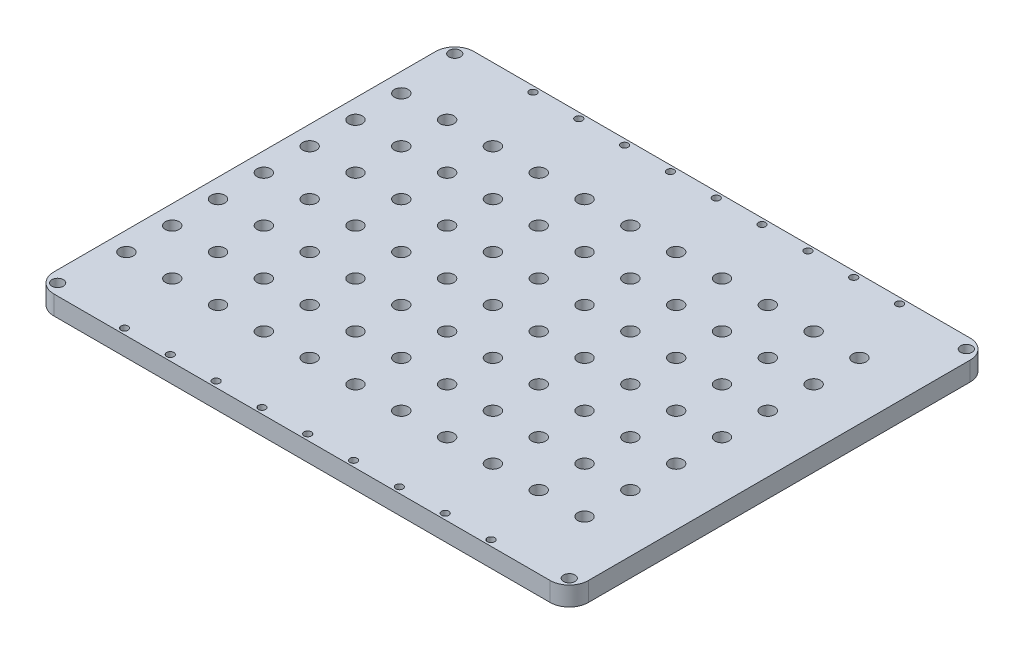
SolidWorks part; units mm, degrees
ref_plane "Front Plane" through (0, 0, 0) normal (0, 0, 1) x (1, 0, 0)
ref_plane "Top Plane" through (0, 0, 0) normal (0, 1, 0) x (1, 0, 0)
ref_plane "Right Plane" through (0, 0, 0) normal (1, 0, 0) x (0, 0, -1)
sketch "Sketch1" plane through (0, 0, 0) normal (0, 1, 0) x (1, 0, 0)
  line L1 (-70, 55) -> (70, 55)
  line L2 (-70, 55) -> (-70, -55)
  line L3 (-70, -55) -> (70, -55)
  line L4 (70, 55) -> (70, -55)
  line L5 (-70, 55) -> (70, -55) construction
  line L6 (-70, -55) -> (70, 55) construction
  point P0 (0, 0)
  dimension "D1" = 110
  dimension "D2" = 140
extrude "Boss-Extrude1" add sketch "Sketch1" along normal blind 5
fillet "Fillet1" radius 5 4 edges at (70, 2.5, -55) (70, 2.5, 55) (-70, 2.5, 55) (-70, 2.5, -55)
sketch "Sketch2" plane through (0, 5, 0) normal (0, 1, 0) x (1, 0, 0)
  line L4 (-68.5355, 53.5355) -> (-67.0011, 52.0011)
  line L8 (67, -50) -> (67, 50)
  line L9 (65, 52) -> (-65, 52)
  line L10 (-67, 50) -> (-67, -50)
  line L11 (-65, -52) -> (65, -52)
  line L12 (67, -50) -> (67, 50)
  line L13 (65, 52) -> (-65, 52)
  line L14 (-67, 50) -> (-67, -50)
  line L15 (-65, -52) -> (65, -52)
  arc A6 (-65, 55) -> (-70, 50) centre (-65, 50) ccw construction
  circle A7 centre (-67.0011, 52.0011) radius 1.5
  arc A8 (67, 50) -> (65, 52) centre (65, 50) ccw
  arc A9 (-65, 52) -> (-67, 50) centre (-65, 50) ccw
  arc A10 (-67, -50) -> (-65, -52) centre (-65, -50) ccw
  arc A11 (65, -52) -> (67, -50) centre (65, -50) ccw
  arc A12 (67, 50) -> (65, 52) centre (65, 50) ccw
  arc A13 (-65, 52) -> (-67, 50) centre (-65, 50) ccw
  arc A14 (-67, -50) -> (-65, -52) centre (-65, -50) ccw
  arc A15 (65, -52) -> (67, -50) centre (65, -50) ccw
  circle A16 centre (66.9989, 52.0011) radius 1.5
  circle A17 centre (66.9989, -51.9989) radius 1.5
  circle A18 centre (-67.0011, -51.9989) radius 1.5
  dimension "D2" = 2
  dimension "D1" = 3
  dimension "D3" = 2
extrude "Cut-Extrude1" cut sketch "Sketch2" against normal blind 5
sketch "Sketch3" plane through (0, 5, 0) normal (0, 1, 0) x (1, 0, 0)
  line L0 (0, -55) -> (0, -52)
  line L1 (-65, -55) -> (65, -55) construction
  circle A0 centre (0, -53.5) radius 0.95
  circle A1 centre (12, -53.5) radius 0.95
  circle A2 centre (24, -53.5) radius 0.95
  circle A3 centre (36, -53.5) radius 0.95
  circle A4 centre (48, -53.5) radius 0.95
  circle A5 centre (0, -53.5) radius 0.95
  circle A6 centre (12, -53.5) radius 0.95
  circle A7 centre (24, -53.5) radius 0.95
  circle A8 centre (36, -53.5) radius 0.95
  circle A9 centre (-12, -53.5) radius 0.95
  circle A10 centre (0, -53.5) radius 0.95
  circle A11 centre (12, -53.5) radius 0.95
  circle A12 centre (24, -53.5) radius 0.95
  circle A13 centre (-24, -53.5) radius 0.95
  circle A14 centre (-12, -53.5) radius 0.95
  circle A15 centre (0, -53.5) radius 0.95
  circle A16 centre (12, -53.5) radius 0.95
  circle A17 centre (-36, -53.5) radius 0.95
  circle A18 centre (-24, -53.5) radius 0.95
  circle A19 centre (-12, -53.5) radius 0.95
  circle A20 centre (0, -53.5) radius 0.95
  circle A21 centre (-12, -53.5) radius 0.95
  circle A22 centre (-24, -53.5) radius 0.95
  circle A23 centre (-36, -53.5) radius 0.95
  circle A24 centre (-48, -53.5) radius 0.95
  dimension "D2" = 5
  dimension "D1" = 3
  dimension "D3" = 5
extrude "Cut-Extrude2" cut sketch "Sketch3" against normal blind 5 contours A24 | A17 | A13 | A9 | A0 | A1 | A2 | A4 | A3
mirror "Mirror1" about plane through (0, 0, 0) normal (0, 0, 1) of "Cut-Extrude2"
sketch "Sketch4" plane through (0, 5, 0) normal (0, 1, 0) x (1, 0, 0)
  line L0 (-70, 0) -> (-65, 0)
  line L2 (-70, 50) -> (-70, -50) construction
  circle A0 centre (-65, 0) radius 1.8
  circle A1 centre (-65, 12) radius 1.8
  circle A2 centre (-65, 24) radius 1.8
  circle A3 centre (-65, 36) radius 1.8
  circle A4 centre (-65, 0) radius 1.8
  circle A5 centre (-65, 12) radius 1.8
  circle A6 centre (-65, 24) radius 1.8
  circle A7 centre (-65, -12) radius 1.8
  circle A8 centre (-65, 0) radius 1.8
  circle A9 centre (-65, 12) radius 1.8
  circle A10 centre (-65, -24) radius 1.8
  circle A11 centre (-65, -12) radius 1.8
  circle A12 centre (-65, 0) radius 1.8
  circle A13 centre (-65, -12) radius 1.8
  circle A14 centre (-65, -24) radius 1.8
  circle A15 centre (-65, -36) radius 1.8
  dimension "D2" = 4
  dimension "D1" = 5
  dimension "D3" = 4
extrude "Cut-Extrude5" cut sketch "Sketch4" against normal blind 5
pattern_linear "LPattern2" count 11 spacing 12 along (1, 0, 0) of "Cut-Extrude5"
